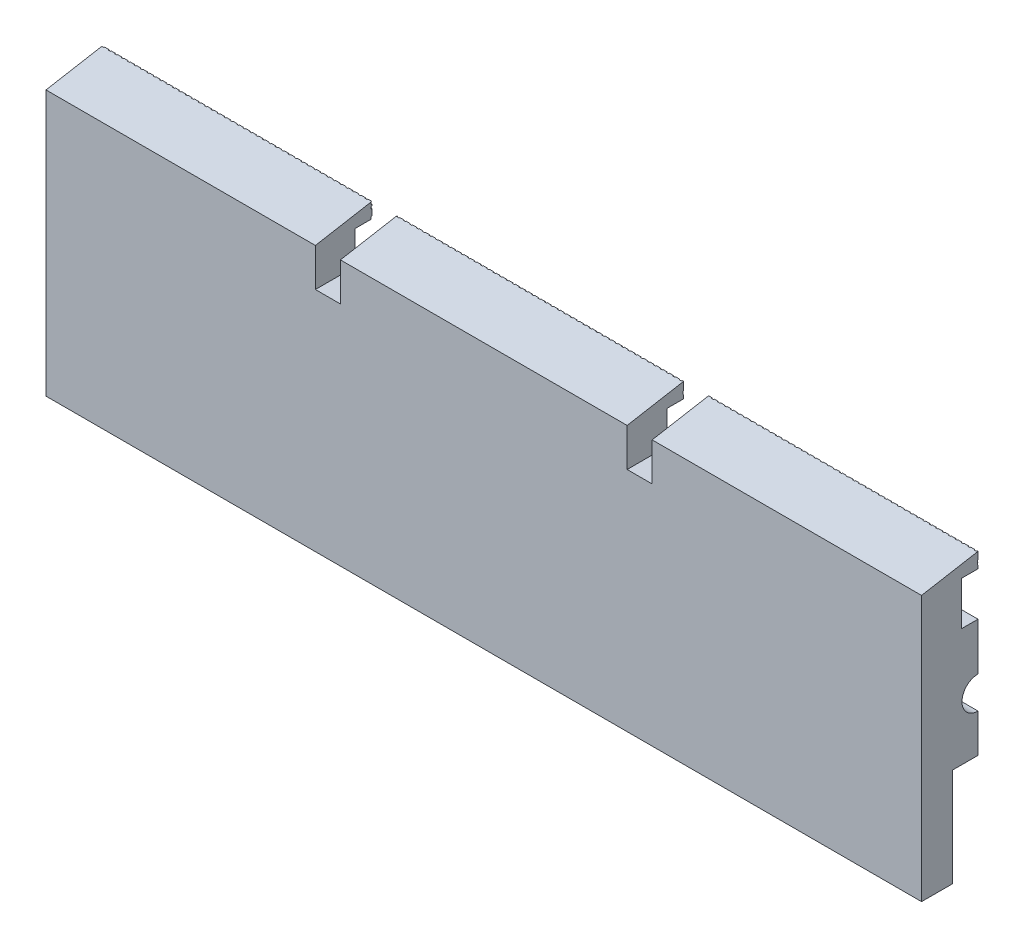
SolidWorks part; units mm, degrees
ref_plane "Plan de face" through (0, 0, 0) normal (0, 0, 1) x (1, 0, 0)
ref_plane "Plan de dessus" through (0, 0, 0) normal (0, 1, 0) x (1, 0, 0)
ref_plane "Plan de droite" through (0, 0, 0) normal (1, 0, 0) x (0, 0, -1)
imported_body "Importée1"
sketch "Esquisse1" plane through (-68.25, 0, 0) normal (-1, 0, 0) x (0, 0, 1)
  line L1 (0, 19.9908) -> (2.6, 19.9908)
  line L2 (0, 19.9908) -> (0, 13.1908)
  line L3 (0, 13.1908) -> (2.6, 13.1908)
  line L4 (2.6, 19.9908) -> (2.6, 13.1908)
  dimension "D1" = 2.6
  dimension "D2" = 6.8
extrude "rainure prismatique" cut sketch "Esquisse1" against normal through all
sketch "Esquisse2" plane through (-68.25, 0, 0) normal (-1, 0, 0) x (0, 0, 1)
  line L0 (0, 13.1908) -> (0, -20.55) construction
  line L1 (0, 0.7908) -> (0, 5.7908)
  arc A0 (0, 5.7908) -> (0, 0.7908) centre (0, 3.2908) cw
  dimension "D1" = 7.4
  dimension "D2" = 2.5
extrude "rainure cylindrique" cut sketch "Esquisse2" against normal through all
sketch "Esquisse3" plane through (-68.25, 0, 0) normal (-1, 0, 0) x (0, 0, 1)
  line L0 (0, 0.7908) -> (0, -20.55) construction
  line L1 (-9.5797, -28.982) -> (4, -28.982)
  line L2 (-9.5797, -28.982) -> (-9.5797, -5.2017)
  line L3 (-9.5797, -5.2017) -> (4, -5.2017)
  line L4 (4, -28.982) -> (4, -5.2017)
  dimension "D1" = 4
  dimension "D2" = 26
extrude "MIP 3" cut sketch "Esquisse3" against normal through all
sketch "Esquisse4" plane through (0, 0, 4) normal (0, 0, -1) x (-1, 0, 0)
  line L0 (68.25, -20.55) -> (-68.25, -20.55) construction
  circle A0 centre (-50, -12.65) radius 4.5
  circle A1 centre (0, -12.65) radius 4.5
  circle A2 centre (50, -12.65) radius 4.5
  dimension "D1" = 50
  dimension "D3" = 9
  dimension "D4" = 9
  dimension "D5" = 9
  dimension "D2" = 50
  dimension "D6" = 7.9
extrude "percage diam. 9" [suppressed] cut sketch "Esquisse4" against normal through all
sketch "Esquisse5" plane through (68.25, 0, 0) normal (1, 0, 0) x (0, 0, -1)
  line L0 (-8.8, -16.55) -> (-8.8, -20.55)
  line L1 (-8.8, -20.55) -> (-4.8, -20.55)
  line L2 (-4.8, -20.55) -> (-8.8, -16.55)
  line L3 (-4, -20.55) -> (-4.8, -20.55) construction
extrude "Boss.-Extru.1" add sketch "Esquisse5" against normal up to surface (136.5 mm away)
